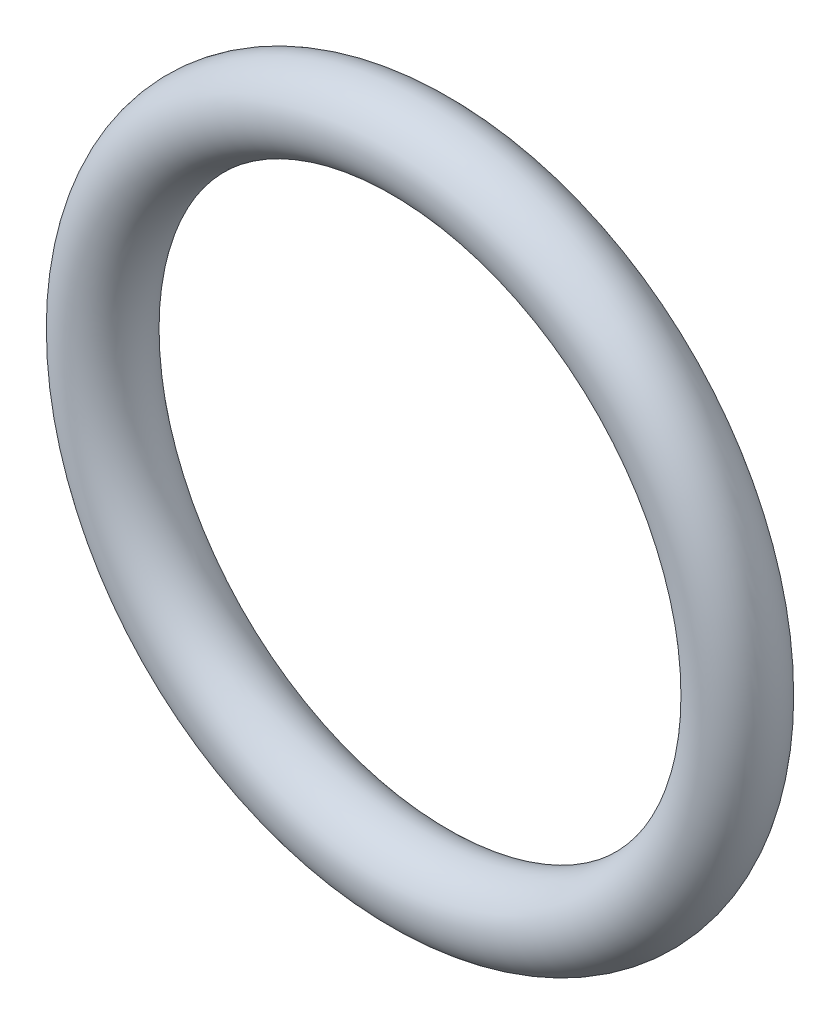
SolidWorks part; units mm, degrees
ref_plane "Plan de face" through (0, 0, 0) normal (0, 0, 1) x (1, 0, 0)
ref_plane "Plan de dessus" through (0, 0, 0) normal (0, 1, 0) x (1, 0, 0)
ref_plane "Plan de droite" through (0, 0, 0) normal (1, 0, 0) x (0, 0, -1)
sketch "Esquisse1" plane through (0, 0, 0) normal (1, 0, 0) x (0, 0, -1)
  line L0 (0, 0) -> (61.3611, 0) construction
  circle A0 centre (0, 4.575) radius 0.575
  dimension "D1" = 8
  dimension "D2" = 1.15
revolve "Révolution1" add sketch "Esquisse1" angle 360 about L0
